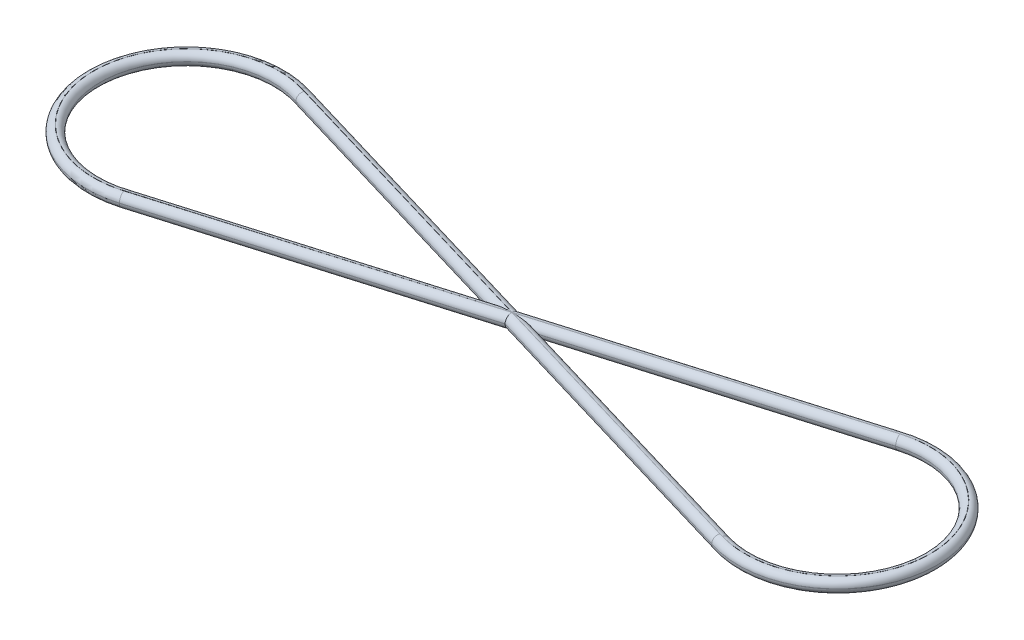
SolidWorks part; units mm, degrees
ref_plane "Plan de face" through (0, 0, 0) normal (0, 0, 1) x (1, 0, 0)
ref_plane "Plan de dessus" through (0, 0, 0) normal (0, 1, 0) x (1, 0, 0)
ref_plane "Plan de droite" through (0, 0, 0) normal (1, 0, 0) x (0, 0, -1)
sketch "Esquisse1" plane through (0, 0, 0) normal (0, 1, 0) x (1, 0, 0)
  line L0 (10.6707, 35.9498) -> (122.995, 2.6093)
  line L1 (10.6707, 30.6983) -> (114.1955, 0)
  line L2 (122.995, 2.6093) -> (233.9454, 35.5095)
  line L3 (10.6707, -35.9498) -> (122.995, -2.6093)
  line L4 (122.995, -2.6093) -> (233.9421, -35.5086)
  line L5 (10.6707, -30.6983) -> (114.1955, 0)
  line L6 (131.7857, 0) -> (236.752, -31.1565)
  line L7 (131.7857, 0) -> (236.752, 31.1565)
  arc A0 (10.6707, 30.6983) -> (10.6707, -30.6983) centre (0, 0) ccw
  arc A2 (236.752, -31.1565) -> (236.752, 31.1565) centre (246, 0) ccw
  arc A3 (233.9421, -35.5086) -> (233.9421, 35.5086) centre (246, 0) ccw
  arc A4 (10.6707, 35.9498) -> (10.6707, -35.9498) centre (0, 0) ccw
  dimension "D1" = 65
  dimension "D3" = 65
  dimension "D4" = 75
  dimension "D5" = 246
extrude "Extrusion7" add sketch "Esquisse1" along normal blind 5
fillet "Congé2" radius 2.47 24 edges at (62.4331, 5, -15.3491) (178.4685, 0, -19.0589) (283.5, 0, 0) (178.4685, 0, 19.0589) (66.8328, 0, 19.2795) (-37.5, 0, 0) (66.8328, 0, -19.2795) (62.4331, 5, 15.3491) (184.2689, 0, -15.5782) (184.2689, 0, 15.5782) (278.5, 0, 0) (62.4331, 0, 15.3491) (62.4331, 0, -15.3491) (-32.5, 0, 0) (278.5, 5, 0) (184.2689, 5, 15.5782) (184.2689, 5, -15.5782) (66.8328, 5, -19.2795) (-37.5, 5, 0) (66.8328, 5, 19.2795) (178.4685, 5, 19.0589) (283.5, 5, 0) (178.4685, 5, -19.0589) (-32.5, 5, 0)
